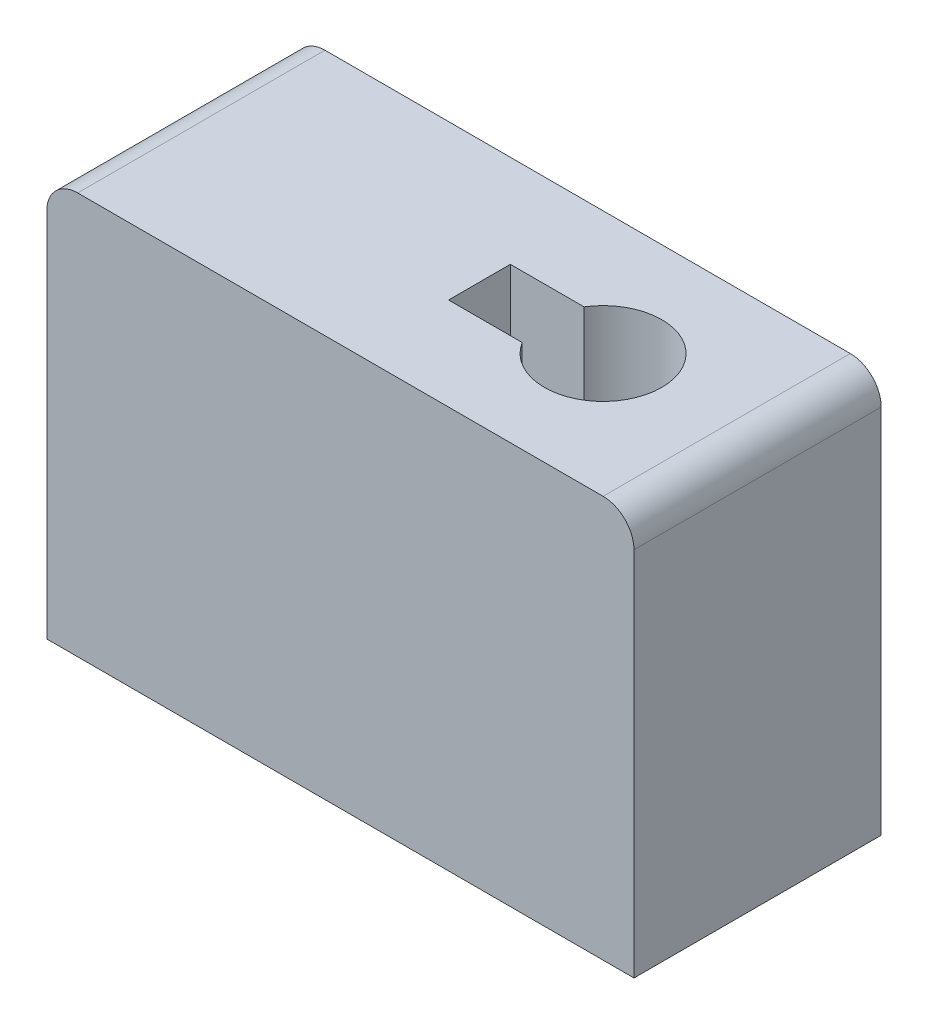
SolidWorks part; units mm, degrees
ref_plane "Front" through (0, 0, 0) normal (0, 0, 1) x (1, 0, 0)
ref_plane "Top" through (0, 0, 0) normal (0, 1, 0) x (1, 0, 0)
ref_plane "Right" through (0, 0, 0) normal (1, 0, 0) x (0, 0, -1)
sketch "草图1" plane through (0, 0, 0) normal (0, 1, 0) x (1, 0, 0)
  line L1 (0, 0) -> (19, 0)
  line L2 (0, 0) -> (0, 8)
  line L3 (0, 8) -> (19, 8)
  line L4 (19, 0) -> (19, 8)
  circle A0 centre (5, 4) radius 2.7
  circle A1 centre (14, 4) radius 2.7
  dimension "D1" = 5.4
  dimension "D2" = 5.4
  dimension "D3" = 19
  dimension "D4" = 8
  dimension "D5" = 4
  dimension "D6" = 4
  dimension "D7" = 5
  dimension "D8" = 5
extrude "凸台-拉伸1" add sketch "草图1" along normal blind 10
sketch "草图2" plane through (0, 10, 0) normal (0, 1, 0) x (1, 0, 0)
  line L0 (0, 8) -> (0, 0) construction
  line L1 (0, 0) -> (19, 0) construction
  line L2 (19, 0) -> (19, 8) construction
  line L3 (19, 8) -> (0, 8) construction
  line L4 (0, 8) -> (0, 0)
  line L5 (0, 0) -> (19, 0)
  line L6 (19, 0) -> (19, 8)
  line L7 (19, 8) -> (0, 8)
  circle A1 centre (14, 4) radius 1.9
  dimension "D1" = 3.8
extrude "凸台-拉伸2" add sketch "草图2" along normal blind 3
fillet "圆角1" radius 1 2 edges at (19, 13, -4) (0, 13, -4)
sketch "草图3" plane through (0, 13, 0) normal (0, 1, 0) x (1, 0, 0)
  line L0 (12.3845, 5) -> (10, 5)
  line L1 (10, 5) -> (10, 3)
  line L2 (10, 3) -> (12.3845, 3)
  line L3 (18, 8) -> (1, 8) construction
  line L4 (1, 0) -> (18, 0) construction
  circle A0 centre (14, 4) radius 1.9 construction
  dimension "D1" = 2
  dimension "D2" = 3
  dimension "D3" = 3
  dimension "D4" = 4
extrude "切除-拉伸2" cut sketch "草图3" against normal through all and the other way through all contours L1 L2 L0 M8
